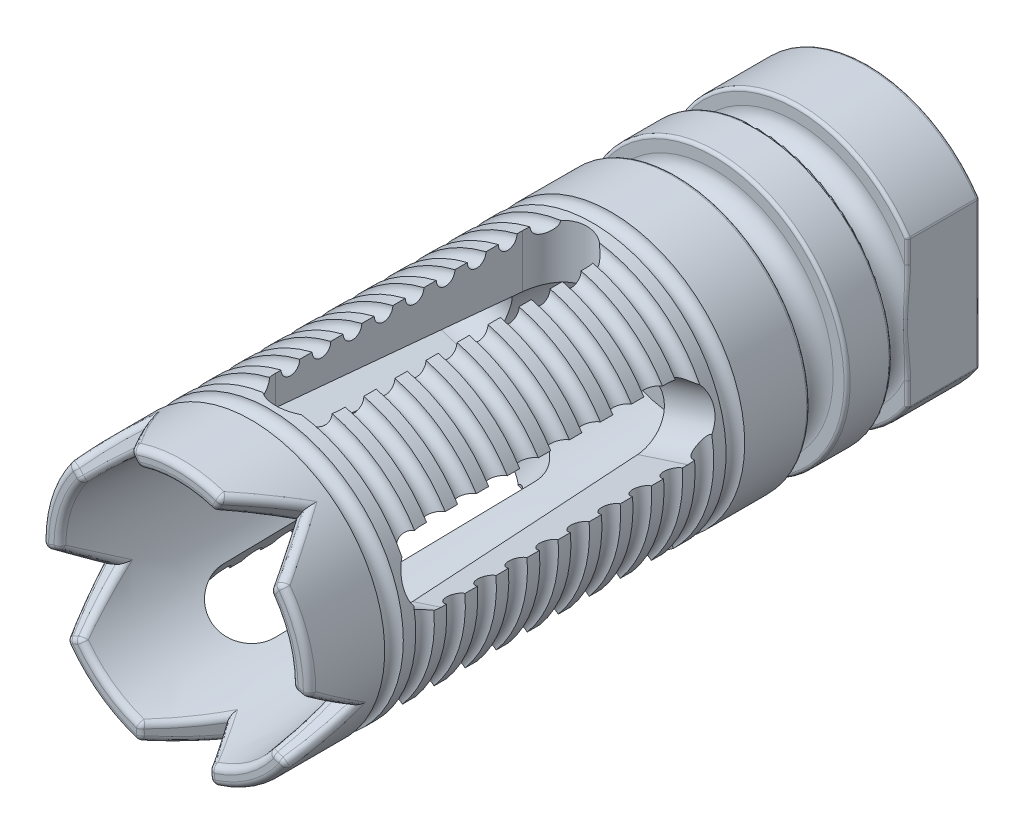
SolidWorks part; units mm, degrees
ref_plane "Front Plane" through (0, 0, 0) normal (0, 0, 1) x (1, 0, 0)
ref_plane "Top Plane" through (0, 0, 0) normal (0, 1, 0) x (1, 0, 0)
ref_plane "Right Plane" through (0, 0, 0) normal (1, 0, 0) x (0, 0, -1)
sketch "Sketch1" plane through (0, 0, 0) normal (0, 0, 1) x (1, 0, 0)
  circle A0 centre (0, 0) radius 10.9347
extrude "Boss-Extrude1" add sketch "Sketch1" along normal blind 56.642
sketch "Sketch2" plane through (0, 0, 0) normal (1, 0, 0) x (0, 0, -1)
  line L0 (0, 0) -> (-59.7388, 0) construction
  line L1 (0, -10.9347) -> (0, 10.9347) construction
  line L2 (-8.9662, 13.2066) -> (-5.9182, 13.2066)
  line L3 (-8.9662, 13.2066) -> (-8.9662, 9.7917)
  line L4 (-7.5692, 8.3947) -> (-7.3152, 8.3947)
  line L5 (-5.9182, 13.2066) -> (-5.9182, 9.7917)
  line L6 (-15.6972, 13.2066) -> (-12.6492, 13.2066)
  line L7 (-15.6972, 13.2066) -> (-15.6972, 9.7917)
  line L8 (-14.3002, 8.3947) -> (-14.0462, 8.3947)
  line L9 (-12.6492, 13.2066) -> (-12.6492, 9.7917)
  line L10 (0, 10.9347) -> (-56.642, 10.9347) construction
  arc A0 (-7.3152, 8.3947) -> (-5.9182, 9.7917) centre (-7.3152, 9.7917) ccw
  arc A1 (-8.9662, 9.7917) -> (-7.5692, 8.3947) centre (-7.5692, 9.7917) ccw
  arc A2 (-14.0462, 8.3947) -> (-12.6492, 9.7917) centre (-14.0462, 9.7917) ccw
  arc A3 (-15.6972, 9.7917) -> (-14.3002, 8.3947) centre (-14.3002, 9.7917) ccw
  dimension "D6" = 1.397
  dimension "D1" = 5.9182
  dimension "D2" = 3.048
  dimension "D3" = 3.048
  dimension "D4" = 3.683
  dimension "D5" = 2.54
revolve "Cut-Revolve1" cut sketch "Sketch2" angle 360 about L0
sketch "Sketch3" plane through (0, 0, 0) normal (0, 0, -1) x (-1, 0, 0)
  circle A0 centre (0, 0) radius 5.842
  dimension "D1" = 11.684
extrude "Cut-Extrude1" cut sketch "Sketch3" against normal blind 14.7828
sketch "Sketch4" plane through (0, 0, 14.7828) normal (0, 0, -1) x (-1, 0, 0)
  circle A0 centre (0, 0) radius 3.175
extrude "Cut-Extrude2" cut sketch "Sketch4" against normal through all
sketch "Sketch5" plane through (0, 0, 0) normal (1, 0, 0) x (0, 0, -1)
  line L0 (0, 0) -> (-60.1808, 0) construction
  line L1 (-15.6972, 10.9347) -> (-56.642, 10.9347) construction
  line L2 (-15.6972, -10.9347) -> (-15.6972, 10.9347) construction
  circle A0 centre (-21.7932, 10.9347) radius 0.762
  circle A1 centre (-24.3332, 10.9347) radius 0.762
  circle A2 centre (-26.8732, 10.9347) radius 0.762
  circle A3 centre (-29.4132, 10.9347) radius 0.762
  circle A4 centre (-31.9532, 10.9347) radius 0.762
  circle A5 centre (-34.4932, 10.9347) radius 0.762
  circle A6 centre (-37.0332, 10.9347) radius 0.762
  circle A7 centre (-39.5732, 10.9347) radius 0.762
  circle A8 centre (-42.1132, 10.9347) radius 0.762
  circle A9 centre (-44.6532, 10.9347) radius 0.762
  circle A10 centre (-47.1932, 10.9347) radius 0.762
  circle A11 centre (-49.7332, 10.9347) radius 0.762
  dimension "D1" = 6.096
  dimension "D2" = 12
revolve "Cut-Revolve2" cut sketch "Sketch5" angle 360 about L0
sketch "Sketch6" plane through (0, 0, 56.642) normal (0, 0, 1) x (1, 0, 0)
  circle A0 centre (0, 0) radius 9.525
  dimension "D1" = 19.05
extrude "Cut-Extrude3" cut sketch "Sketch6" against normal blind 40.64 draft 5
sketch "Sketch7" plane through (0, 0, 0) normal (0, 0, -1) x (-1, 0, 0)
  line L0 (0, 0) -> (0, 11.5574) construction
  line L1 (-14.297, 10.5268) -> (-14.297, -10.8948)
  line L2 (9.144, 10.5268) -> (14.297, 10.5268)
  line L3 (9.144, 10.5268) -> (9.144, -10.8948)
  line L4 (9.144, -10.8948) -> (14.297, -10.8948)
  line L5 (14.297, 10.5268) -> (14.297, -10.8948)
  line L6 (-9.144, -10.8948) -> (-14.297, -10.8948)
  line L7 (-9.144, 10.5268) -> (-9.144, -10.8948)
  line L8 (-9.144, 10.5268) -> (-14.297, 10.5268)
  circle A0 centre (0, 0) radius 5.9695 construction
  circle A2 centre (0, 0) radius 5.842 construction
  dimension "D1" = 9.144
extrude "Cut-Extrude4" cut sketch "Sketch7" against normal blind 7.1628
fillet "Fillet1" radius 0.254 19 edges at (-9.144, 5.9962, 2.9591) (-9.144, -5.9962, 2.9591) (-9.144, 0, 0) (-9.144, -4.7492, 5.9182) (-9.144, 4.7492, 5.9182) (-9.144, 1.225, 8.5924) (9.144, -5.9962, 2.9591) (9.144, 5.9962, 2.9591) (9.144, 0, 0) (9.144, 4.7492, 5.9182) (9.144, -4.7492, 5.9182) (9.144, -1.225, 8.5924) (10.9347, 0, 15.6972) (-10.9347, 0, 12.6492) (10.9347, 0, 8.9662) (0, -10.9347, 5.9182) (0, 10.9347, 5.9182) (0, 10.9347, 0) (0, -10.9347, 0)
sketch "Sketch8" plane through (0, 0, 0) normal (0, 1, 0) x (1, 0, 0)
  line L0 (0, 0) -> (0, -60.2566) construction
  line L1 (0, -25.6518) -> (0, -45.8618) construction
  line L2 (2.6216, -25.6518) -> (2.6216, -45.8618)
  line L3 (-2.6216, -25.6518) -> (-2.6216, -45.8618)
  arc A0 (2.6216, -25.6518) -> (-2.6216, -25.6518) centre (0, -25.6518) ccw
  arc A1 (-2.6216, -45.8618) -> (2.6216, -45.8618) centre (0, -45.8618) ccw
  point P5 (0, -35.7568)
extrude "Cut-Extrude5" cut sketch "Sketch8" along normal blind 19.8628
pattern_circular "CirPattern1" count 5 over 360 about axis through (0, 0, 0) along (0, 0, 1) of "Cut-Extrude5"
sketch "Sketch9" plane through (0, 0, 0) normal (0, 1, 0) x (1, 0, 0)
  line L0 (0, -59.6847) -> (0, -36.2712) construction
  line L1 (4.1189, -36.2712) -> (-4.1189, -36.2712) construction
ref_plane "Plane1" through (0, 0, 0) normal (0.5299, 0.848, 0) x (0.848, -0.5299, 0)
sketch "Sketch10" plane through (0, 0, 0) normal (0.5299, 0.848, 0) x (0.848, -0.5299, 0)
  line L0 (-3.4023, -45.8618) -> (4.8154, -45.8618) construction
  line L1 (0.7066, -45.8618) -> (0.7066, -58.9414) construction
  line L2 (0.7066, -52.4016) -> (-2.2137, -56.642)
  line L3 (-10.9347, -56.642) -> (10.9347, -56.642) construction
  line L4 (0.7066, -52.4016) -> (3.6268, -56.642)
  line L5 (-2.2137, -56.642) -> (1.4911, -58.6006)
  line L6 (1.4911, -58.6006) -> (3.6268, -56.642)
extrude "Cut-Extrude6" cut sketch "Sketch10" along normal blind 19.8628
pattern_circular "CirPattern2" count 5 over 360 about axis through (0, 0, 0) along (0, 0, 1) of "Cut-Extrude6"
fillet "Fillet2" radius 0.508 40 edges at (2.9049, -9.8075, 56.642) (5.5351, -7.7517, 56.642) (8.4002, -5.8322, 56.642) (6.4511, -8.829, 56.642) (8.1426, 6.1868, 56.642) (10.3904, 3.407, 56.642) (10.2251, -0.268, 56.642) (9.0827, 2.8688, 56.642) (-8.4298, -5.7934, 56.642) (-5.6619, -7.6596, 56.642) (-2.951, -9.7913, 56.642) (-6.4034, -8.8637, 56.642) (-8.1148, 6.227, 56.642) (-9.0343, 3.0178, 56.642) (-10.224, -0.2191, 56.642) (-10.4086, 3.3509, 56.642) (3.4146, 9.6419, 56.642) (0.0783, 9.5247, 56.642) (-3.3678, 9.6559, 56.642) (-0.0295, 10.9347, 56.642) (-9.2384, -1.3818, 54.5405) (-7.5942, 7.8674, 54.5317) (-6.5567, 6.6501, 54.5139) (-5.2112, 9.613, 54.5514) (-4.169, 8.3592, 54.5405) (5.1356, 9.6536, 54.5317) (4.2985, 8.2908, 54.5139) (7.5322, 7.9268, 54.5514) (6.6618, 6.5481, 54.5405) (9.2133, -1.5261, 54.5139) (10.7682, -1.9011, 54.5317) (9.8664, -4.714, 54.5514) (1.5194, -10.8286, 54.5317) (-1.4344, -10.8402, 54.5514) (-9.8291, -4.7913, 54.5317) (-10.7529, -1.9856, 54.5514) (-8.3507, -4.1808, 54.5139) (-1.5407, -9.2132, 54.5405) (1.3956, -9.2339, 54.5139) (8.2862, -4.3123, 54.5405)
